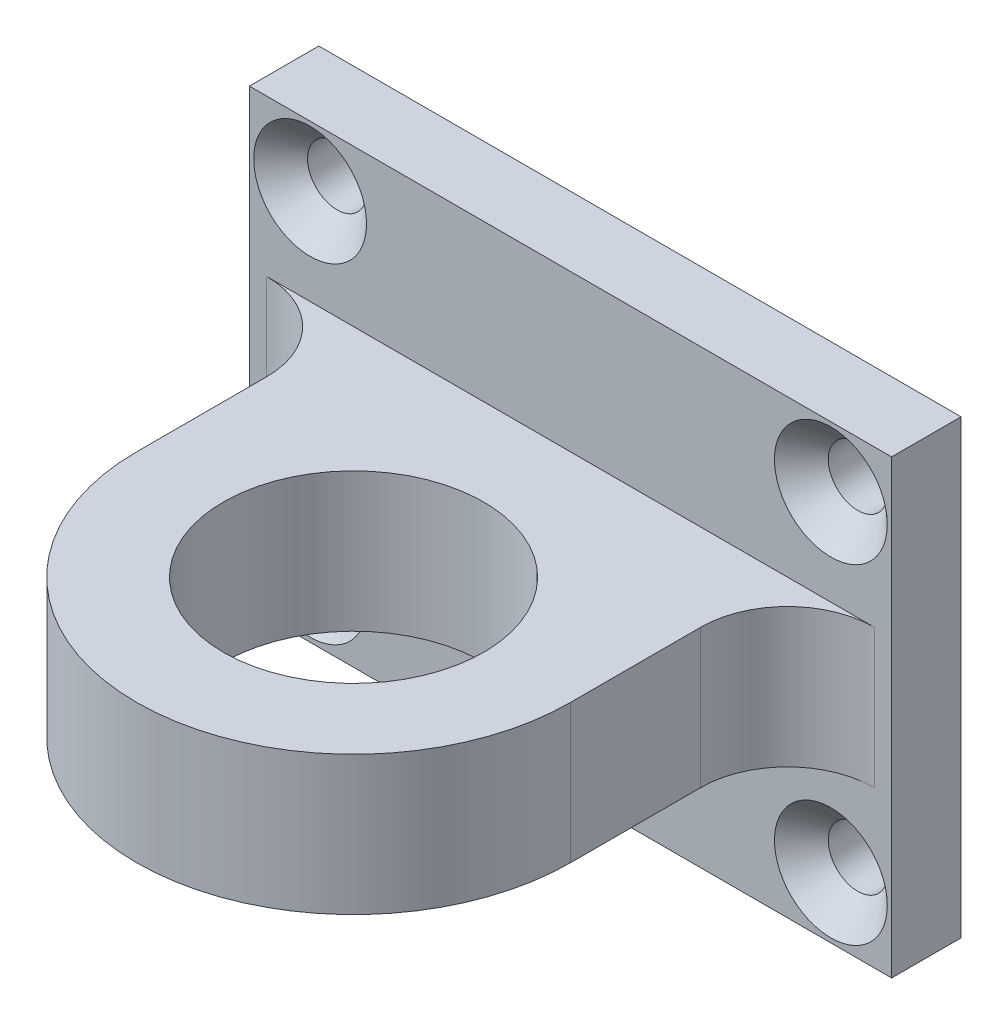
SolidWorks part; units mm, degrees
ref_plane "Спереди" through (0, 0, 0) normal (0, 0, 1) x (1, 0, 0)
ref_plane "Сверху" through (0, 0, 0) normal (0, 1, 0) x (1, 0, 0)
ref_plane "Справа" through (0, 0, 0) normal (1, 0, 0) x (0, 0, -1)
sketch "Эскиз1" plane through (0, 0, 0) normal (0, 0, 1) x (1, 0, 0)
  line L1 (-18.5, 13) -> (18.5, 13)
  line L2 (-18.5, 13) -> (-18.5, -13)
  line L3 (-18.5, -13) -> (18.5, -13)
  line L4 (18.5, 13) -> (18.5, -13)
  point P4 (0, -13)
  point P6 (18.5, 0)
  dimension "D1" = 37
  dimension "D2" = 26
extrude "Вытянуть1" add sketch "Эскиз1" along normal blind 4
sketch "Эскиз2" plane through (0, 0, 0) normal (0, 1, 0) x (1, 0, 0)
  line L0 (18.5, -4) -> (-18.5, -4) construction
  line L1 (12.5, -4) -> (-12.5, -4)
  line L2 (-12.5, -4) -> (-12.5, -16.5)
  line L3 (12.5, -16.5) -> (12.5, -4)
  line L4 (18.5, 0) -> (-18.5, 0) construction
  arc A0 (-12.5, -16.5) -> (12.5, -16.5) centre (0, -16.5) ccw
  circle A1 centre (0, -16.5) radius 7.5
  dimension "D2" = 29
  dimension "D3" = 15
  dimension "D1" = 25
extrude "Вытянуть2" add sketch "Эскиз2" along normal mid plane 8
hole_wizard "Зенковка для винта с потайной головкой M31" positions "Эскиз4" profile "Эскиз3" countersink size "M3" standard "ГОСТ"
sketch "Эскиз4" plane through (0, 0, 4) normal (0, 0, 1) x (1, 0, 0)
  line L1 (-15, -9.5) -> (15, -9.5) construction
  line L2 (15, -9.5) -> (15, 9.5) construction
  line L3 (0, -9.5) -> (0, 0) construction
  line L4 (15, 0) -> (0, 0) construction
  point P0 (-15, -9.5)
  point P1 (15, -9.5)
  point P3 (-15, 9.5)
  point P5 (15, 9.5)
  dimension "D1" = 30
  dimension "D2" = 19
sketch "Эскиз3" plane through (-15, -9.5, 4) normal (1, 0, 0) x (0, -1, 0)
  line L0 (0, 0) -> (0, 4)
  line L1 (0, 4) -> (1.7, 4)
  line L2 (1.7, 4) -> (1.7, 1.55)
  line L3 (1.7, 1.55) -> (3.25, 0)
  line L5 (3.25, 0) -> (0, 0)
  line L6 (-1.7, 1.55) -> (-3.25, 0) construction
  line L11 (0, -6.35) -> (0, 107.95) construction
  dimension "Диаметр сквозного отверстия" = 3.4
  dimension "Глубина сквозного отверстия" = 4
  dimension "Диаметр передней зенковки" = 6.5
  dimension "Угол передней зенковки" = 90
fillet "Скругление1" radius 5 2 edges at (-12.5, 0, 4) (12.5, 0, 4)
